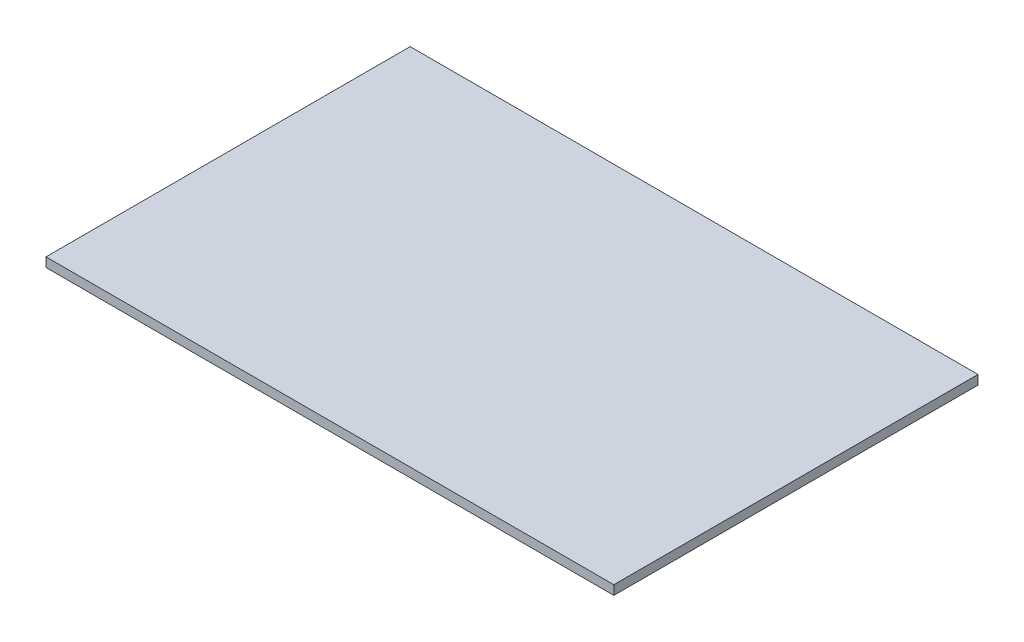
SolidWorks part; units mm, degrees
ref_plane "Front Plane" through (0, 0, 0) normal (0, 0, 1) x (1, 0, 0)
ref_plane "Top Plane" through (0, 0, 0) normal (0, 1, 0) x (1, 0, 0)
ref_plane "Right Plane" through (0, 0, 0) normal (1, 0, 0) x (0, 0, -1)
sketch "Sketch2" plane through (0, 0, 0) normal (0, 1, 0) x (1, 0, 0)
  line L1 (0, 0) -> (1168.4, 0)
  line L2 (0, 0) -> (0, 749.3)
  line L3 (0, 749.3) -> (1168.4, 749.3)
  line L4 (1168.4, 0) -> (1168.4, 749.3)
  line L5 (0, 0) -> (1168.4, 749.3) construction
  line L6 (0, 749.3) -> (1168.4, 0) construction
  point P4 (584.2, 374.65)
extrude "Boss-Extrude1" add sketch "Sketch2" along normal blind 19.05
equation "\"system_width\"= 7ft + 10 "
equation "\"system_length\"= 95.5"
equation "\"module_board_length\"= 11.25in"
equation "\"module_board_width\"= 1.5in"
equation "\"module_width\"= (\"system_width\" -  2* \"module_trim_thickness\") / 2"
equation "\"module_length\"= (\"system_top_length\" - \"module_trim_thickness\")/ 2"
equation "\"module_board_long_depth\"= \"module_length\" - \"module_lip_width\""
equation "\"module_board_short_depth\"= \"module_width\" - ( 2 * \"module_board_width\" ) - \"module_lip_width\""
equation "\"module_board_hole\"= 0.5in"
equation "\"module_board_hole_position\"= ( ( \"module_width\" - \"module_board_hole_seperation\" ) / 2 ) + \"module_board_width\"/2"
equation "\"module_board_hole_seperation\"= 20in"
equation "\"module_top_length\"= \"module_length\" + \"module_lip_width\""
equation "\"module_top_width\"= \"module_width\" + \"module_lip_width\""
equation "\"module_top_thickness\"= 0.75in"
equation "\"system_step_width\"= 3ft"
equation "\"system_top_length\"= \"system_length\" - \"system_step_length\""
equation "\"module_lip_width\"= 1.5in"
equation "\"module_trim_thickness\"= 1in"
equation "\"module_trim_height\"= 14in"
equation "\"D2@Sketch2\"=\"module_width\""
equation "\"D1@Sketch2\"=\"module_length\""
equation "\"step_board_length\"= 5.5in"
equation "\"step_board_width\"= 1.5in"
equation "\"system_step_length\"= 2ft+11.5"
equation "\"module_top_overhang\"= 4.5in"
equation "\"module_trim_angle\"= 45deg"
equation "\"step_module_width\"= \"module_width\""
equation "\"step_module_length\"= \"system_step_length\" - \"module_trim_thickness\""
equation "\"step_board_short_depth\"= \"step_module_length\" - \"module_lip_width\""
equation "\"step_board_long_depth\"= \"step_module_width\" - (2 * \"module_board_width\") - \"module_lip_width\""
